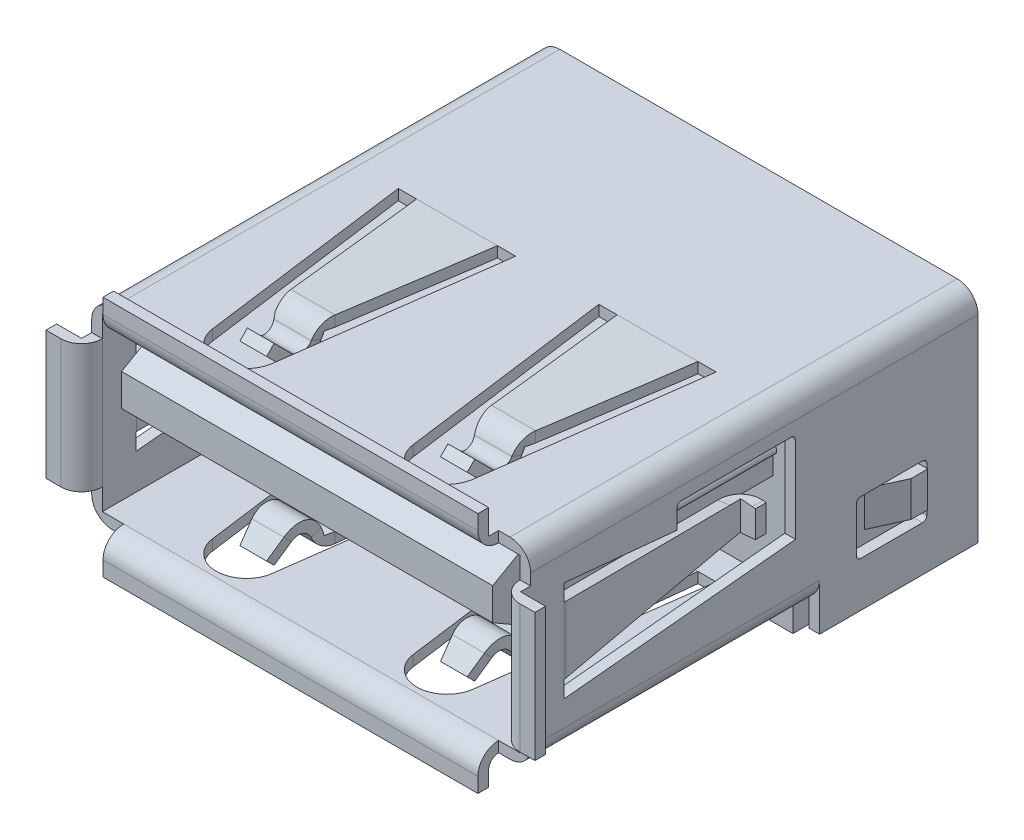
SolidWorks part; units mm, degrees
ref_plane "Front Plane" through (0, 0, 0) normal (0, 0, 1) x (1, 0, 0)
ref_plane "Top Plane" through (0, 0, 0) normal (0, 1, 0) x (1, 0, 0)
ref_plane "Right Plane" through (0, 0, 0) normal (1, 0, 0) x (0, 0, -1)
imported_body "Imported3"
ref_plane "Plane1" through (0, 0.14, 0) normal (0, 1, 0) x (1, 0, 0)
sketch "Sketch1" plane through (0, 0.14, 0) normal (0, 1, 0) x (1, 0, 0)
  line L0 (-0.765, 9.88) -> (-1.61, 9.88)
  line L1 (-1.61, 9.88) -> (-1.61, 8.88)
  line L2 (-1.61, 8.88) -> (-0.765, 8.88)
  line L3 (-0.765, 8.88) -> (-0.765, 9.88)
extrude "Cut-Extrude1" cut sketch "Sketch1" against normal blind 0.73
sketch "Sketch2" plane through (0, 0.14, 0) normal (0, 1, 0) x (1, 0, 0)
  line L0 (1.235, 9.88) -> (0.39, 9.88)
  line L1 (0.39, 9.88) -> (0.39, 8.88)
  line L2 (0.39, 8.88) -> (1.235, 8.88)
  line L3 (1.235, 8.88) -> (1.235, 9.88)
extrude "Cut-Extrude2" cut sketch "Sketch2" against normal blind 0.73
sketch "Sketch3" plane through (0, 0.14, 0) normal (0, 1, 0) x (1, 0, 0)
  line L0 (3.735, 9.88) -> (2.89, 9.88)
  line L1 (2.89, 9.88) -> (2.89, 8.88)
  line L2 (2.89, 8.88) -> (3.735, 8.88)
  line L3 (3.735, 8.88) -> (3.735, 9.88)
extrude "Cut-Extrude3" cut sketch "Sketch3" against normal blind 0.73
sketch "Sketch4" plane through (0, 0.14, 0) normal (0, 1, 0) x (1, 0, 0)
  line L0 (-3.265, 9.88) -> (-3.735, 9.88)
  line L1 (-3.735, 9.88) -> (-3.735, 8.88)
  line L2 (-3.735, 8.88) -> (-3.265, 8.88)
  line L3 (-3.265, 8.88) -> (-3.265, 9.88)
extrude "Cut-Extrude4" cut sketch "Sketch4" against normal blind 0.93
sketch "Sketch5" plane through (0, 0.14, 0) normal (0, 1, 0) x (1, 0, 0)
  line L0 (-2.89, 9.88) -> (-3.265, 9.88)
  line L1 (-3.265, 9.88) -> (-3.265, 8.88)
  line L2 (-3.265, 8.88) -> (-2.89, 8.88)
  line L3 (-2.89, 8.88) -> (-2.89, 9.88)
extrude "Cut-Extrude5" cut sketch "Sketch5" against normal blind 0.73
ref_plane "Plane2" through (-0.765, 0, 0) normal (1, 0, 0) x (0, 0, -1)
sketch "Sketch6" plane through (-0.765, 0, 0) normal (1, 0, 0) x (0, 0, -1)
  line L0 (9.88, -0.79) -> (9.88, -0.59)
  line L1 (9.88, -0.59) -> (8.88, -0.59)
  line L2 (8.88, -0.59) -> (8.88, -0.79)
  line L3 (8.88, -0.79) -> (9.88, -0.79)
extrude "Cut-Extrude6" cut sketch "Sketch6" against normal blind 0.47
sketch "Sketch7" plane through (0, 0.14, 0) normal (0, 1, 0) x (1, 0, 0)
  line L0 (-0.39, 9.88) -> (-0.765, 9.88)
  line L1 (-0.765, 9.88) -> (-0.765, 8.88)
  line L2 (-0.765, 8.88) -> (-0.39, 8.88)
  line L3 (-0.39, 8.88) -> (-0.39, 9.88)
extrude "Cut-Extrude7" cut sketch "Sketch7" against normal blind 0.73
ref_plane "Plane3" through (1.235, 0, 0) normal (1, 0, 0) x (0, 0, -1)
sketch "Sketch8" plane through (1.235, 0, 0) normal (1, 0, 0) x (0, 0, -1)
  line L0 (9.88, -0.79) -> (9.88, -0.59)
  line L1 (9.88, -0.59) -> (8.88, -0.59)
  line L2 (8.88, -0.59) -> (8.88, -0.79)
  line L3 (8.88, -0.79) -> (9.88, -0.79)
extrude "Cut-Extrude8" cut sketch "Sketch8" against normal blind 0.47
sketch "Sketch9" plane through (0, 0.14, 0) normal (0, 1, 0) x (1, 0, 0)
  line L0 (1.61, 9.88) -> (1.235, 9.88)
  line L1 (1.235, 9.88) -> (1.235, 8.88)
  line L2 (1.235, 8.88) -> (1.61, 8.88)
  line L3 (1.61, 8.88) -> (1.61, 9.88)
extrude "Cut-Extrude9" cut sketch "Sketch9" against normal blind 0.73
ref_plane "Plane4" through (3.735, 0, 0) normal (1, 0, 0) x (0, 0, -1)
sketch "Sketch10" plane through (3.735, 0, 0) normal (1, 0, 0) x (0, 0, -1)
  line L0 (9.88, -0.79) -> (9.88, -0.59)
  line L1 (9.88, -0.59) -> (8.88, -0.59)
  line L2 (8.88, -0.59) -> (8.88, -0.79)
  line L3 (8.88, -0.79) -> (9.88, -0.79)
extrude "Cut-Extrude10" cut sketch "Sketch10" against normal blind 0.47
sketch "Sketch11" plane through (0, 0.14, 0) normal (0, 1, 0) x (1, 0, 0)
  line L0 (4.11, 9.88) -> (3.735, 9.88)
  line L1 (3.735, 9.88) -> (3.735, 8.88)
  line L2 (3.735, 8.88) -> (4.11, 8.88)
  line L3 (4.11, 8.88) -> (4.11, 9.88)
extrude "Cut-Extrude11" cut sketch "Sketch11" against normal blind 0.73
sketch "Sketch12" plane through (0, 0.14, 0) normal (0, 1, 0) x (1, 0, 0)
  line L0 (-3.735, 9.88) -> (-4.11, 9.88)
  line L1 (-4.11, 9.88) -> (-4.11, 8.88)
  line L2 (-4.11, 8.88) -> (-3.735, 8.88)
  line L3 (-3.735, 8.88) -> (-3.735, 9.88)
extrude "Cut-Extrude12" cut sketch "Sketch12" against normal blind 0.73
sketch "Sketch13" plane through (0, 1, 0) normal (0, -1, 0) x (1, 0, 0)
  line L0 (-6.247, -8.54) -> (-6.247, -1.62)
  line L1 (-6.247, -1.62) -> (-6.565, -1.62)
  line L2 (-6.565, -1.62) -> (-6.565, -8.54)
  line L3 (-6.565, -8.54) -> (-6.247, -8.54)
extrude "Cut-Extrude13" cut sketch "Sketch13" against normal blind 0.1752
sketch "Sketch14" plane through (0, 0, 0) normal (0, 0, 1) x (1, 0, 0)
  line L0 (6.247, 1.92) -> (6.565, 1.92)
  line L1 (6.565, 1.92) -> (6.565, 2.878)
  line L2 (6.565, 2.878) -> (5.607, 2.878)
  line L3 (5.607, 2.878) -> (5.607, 2.56)
  line L4 (5.607, 2.56) -> (6.247, 2.56)
  line L5 (6.247, 2.56) -> (6.247, 1.92)
extrude "Cut-Extrude14" cut sketch "Sketch14" against normal blind 0.62
sketch "Sketch15" plane through (0, 0, 0) normal (0, 0, 1) x (1, 0, 0)
  line L0 (-5.607, 2.56) -> (-5.607, 2.878)
  line L1 (-5.607, 2.878) -> (-6.565, 2.878)
  line L2 (-6.565, 2.878) -> (-6.565, 1.92)
  line L3 (-6.565, 1.92) -> (-6.247, 1.92)
  line L4 (-6.247, 1.92) -> (-6.247, 2.56)
  line L5 (-6.247, 2.56) -> (-5.607, 2.56)
extrude "Cut-Extrude15" cut sketch "Sketch15" against normal blind 0.62
sketch "Sketch16" plane through (0, 0, 0) normal (0, 0, 1) x (1, 0, 0)
  line L0 (-6.247, -1.92) -> (-6.565, -1.92)
  line L1 (-6.565, -1.92) -> (-6.565, -2.878)
  line L2 (-6.565, -2.878) -> (-5.607, -2.878)
  line L3 (-5.607, -2.878) -> (-5.607, -2.56)
  line L4 (-5.607, -2.56) -> (-6.247, -2.56)
  line L5 (-6.247, -2.56) -> (-6.247, -1.92)
extrude "Cut-Extrude16" cut sketch "Sketch16" against normal blind 0.62
sketch "Sketch17" plane through (0, 0, 0) normal (0, 0, 1) x (1, 0, 0)
  line L0 (5.607, -2.56) -> (5.607, -2.878)
  line L1 (5.607, -2.878) -> (6.565, -2.878)
  line L2 (6.565, -2.878) -> (6.565, -1.92)
  line L3 (6.565, -1.92) -> (6.247, -1.92)
  line L4 (6.247, -1.92) -> (6.247, -2.56)
  line L5 (6.247, -2.56) -> (5.607, -2.56)
extrude "Cut-Extrude17" cut sketch "Sketch17" against normal blind 0.62
sketch "Sketch18" plane through (0, 1.1752, 0) normal (0, -1, 0) x (1, 0, 0)
  line L0 (-6.247, -8.54) -> (-6.247, -5)
  line L1 (-6.247, -5) -> (-6.565, -5)
  line L2 (-6.565, -5) -> (-6.565, -8.54)
  line L3 (-6.565, -8.54) -> (-6.247, -8.54)
extrude "Cut-Extrude18" cut sketch "Sketch18" against normal blind 0.7028
sketch "Sketch19" plane through (0, -1, 0) normal (0, 1, 0) x (-1, 0, 0)
  line L0 (6.247, -1.62) -> (6.247, -8.54)
  line L1 (6.247, -8.54) -> (6.565, -8.54)
  line L2 (6.565, -8.54) -> (6.565, -1.62)
  line L3 (6.565, -1.62) -> (6.247, -1.62)
extrude "Cut-Extrude19" cut sketch "Sketch19" against normal blind 0.5023
sketch "Sketch20" plane through (0, 1, 0) normal (0, -1, 0) x (1, 0, 0)
  line L0 (6.247, -1.62) -> (6.247, -8.54)
  line L1 (6.247, -8.54) -> (6.565, -8.54)
  line L2 (6.565, -8.54) -> (6.565, -1.62)
  line L3 (6.565, -1.62) -> (6.247, -1.62)
extrude "Cut-Extrude20" cut sketch "Sketch20" against normal blind 0.1752
sketch "Sketch21" plane through (0, 1.1752, 0) normal (0, -1, 0) x (1, 0, 0)
  line L0 (6.247, -5) -> (6.247, -8.54)
  line L1 (6.247, -8.54) -> (6.565, -8.54)
  line L2 (6.565, -8.54) -> (6.565, -5)
  line L3 (6.565, -5) -> (6.247, -5)
extrude "Cut-Extrude21" cut sketch "Sketch21" against normal blind 0.7028
sketch "Sketch22" plane through (0, -1, 0) normal (0, 1, 0) x (-1, 0, 0)
  line L0 (-6.247, -8.54) -> (-6.247, -1.62)
  line L1 (-6.247, -1.62) -> (-6.565, -1.62)
  line L2 (-6.565, -1.62) -> (-6.565, -8.54)
  line L3 (-6.565, -8.54) -> (-6.247, -8.54)
extrude "Cut-Extrude22" cut sketch "Sketch22" against normal blind 0.5023
sketch "Sketch23" plane through (0, -2.878, 0) normal (0, -1, 0) x (1, 0, 0)
  line L0 (5.607, 0) -> (5.607, -0.318)
  line L1 (5.607, -0.318) -> (-5.607, -0.318)
  line L2 (-5.607, -0.318) -> (-5.607, 0)
  line L3 (-5.607, 0) -> (5.607, 0)
extrude "Boss-Extrude1" add sketch "Sketch23" along normal blind 0.747
sketch "Sketch24" plane through (-6.565, 0, 0) normal (-1, 0, 0) x (0, 0, 1)
  line L0 (0, -1.92) -> (-0.318, -1.92)
  line L1 (-0.318, -1.92) -> (-0.318, 1.92)
  line L2 (-0.318, 1.92) -> (0, 1.92)
  line L3 (0, 1.92) -> (0, -1.92)
extrude "Boss-Extrude2" add sketch "Sketch24" along normal blind 0.747
sketch "Sketch25" plane through (0, 2.878, 0) normal (0, 1, 0) x (-1, 0, 0)
  line L0 (-5.607, -0.318) -> (-5.607, 0)
  line L1 (-5.607, 0) -> (5.607, 0)
  line L2 (5.607, 0) -> (5.607, -0.318)
  line L3 (5.607, -0.318) -> (-5.607, -0.318)
extrude "Boss-Extrude3" add sketch "Sketch25" along normal blind 0.747
sketch "Sketch26" plane through (6.565, 0, 0) normal (1, 0, 0) x (0, 0, -1)
  line L0 (0.318, -1.92) -> (0, -1.92)
  line L1 (0, -1.92) -> (0, 1.92)
  line L2 (0, 1.92) -> (0.318, 1.92)
  line L3 (0.318, 1.92) -> (0.318, -1.92)
extrude "Boss-Extrude4" add sketch "Sketch26" along normal blind 0.747
sketch "Sketch27" plane through (0, 0, -8.88) normal (0, 0, 1) x (1, 0, 0)
  line L0 (-5.7181, 0.84) -> (-5.55, 1.0081)
  line L1 (-5.55, 1.0081) -> (-5.55, 0.6719)
  line L2 (-5.55, 0.6719) -> (-5.7181, 0.84)
extrude "Boss-Extrude5" add sketch "Sketch27" along normal blind 5.38
sketch "Sketch28" plane through (0, 0, -8.88) normal (0, 0, 1) x (1, 0, 0)
  line L0 (5.7181, 0.84) -> (5.55, 0.6719)
  line L1 (5.55, 0.6719) -> (5.55, 1.0081)
  line L2 (5.55, 1.0081) -> (5.7181, 0.84)
extrude "Boss-Extrude6" add sketch "Sketch28" along normal blind 5.38
sketch "Sketch29" plane through (-6.565, 0, 0) normal (-1, 0, 0) x (0, 0, 1)
  line L0 (-10.36, -0.7) -> (-12.47, -0.7)
  line L1 (-12.47, -0.7) -> (-12.47, -2.3)
  line L2 (-12.47, -2.3) -> (-10.36, -2.3)
  line L3 (-10.36, -2.3) -> (-10.36, -0.7)
extrude "Cut-Extrude23" cut sketch "Sketch29" against normal blind 0.318
sketch "Sketch30" plane through (-6.247, 0, 0) normal (-1, 0, 0) x (0, 0, 1)
  line L0 (-12.38, -1.93) -> (-12.38, -0.87)
  line L1 (-12.38, -0.87) -> (-11.88, -0.87)
  line L2 (-11.88, -0.87) -> (-11.88, -1.93)
  line L3 (-11.88, -1.93) -> (-12.38, -1.93)
extrude "Boss-Extrude7" add sketch "Sketch30" along normal blind 0.433
sketch "Sketch31" plane through (6.565, 0, 0) normal (1, 0, 0) x (0, 0, -1)
  line L0 (12.47, -0.7) -> (10.36, -0.7)
  line L1 (10.36, -0.7) -> (10.36, -2.3)
  line L2 (10.36, -2.3) -> (12.47, -2.3)
  line L3 (12.47, -2.3) -> (12.47, -0.7)
extrude "Cut-Extrude24" cut sketch "Sketch31" against normal blind 0.318
sketch "Sketch32" plane through (6.247, 0, 0) normal (1, 0, 0) x (0, 0, -1)
  line L0 (11.88, -1.93) -> (11.88, -0.87)
  line L1 (11.88, -0.87) -> (12.38, -0.87)
  line L2 (12.38, -0.87) -> (12.38, -1.93)
  line L3 (12.38, -1.93) -> (11.88, -1.93)
extrude "Boss-Extrude8" add sketch "Sketch32" along normal blind 0.433
ref_plane "Plane5" through (0, 0, -13.625) normal (0, 0, -1) x (0, 1, 0)
ref_plane "Plane6" through (0, 0, -13.875) normal (0, 0, 1) x (1, 0, 0)
sketch "Sketch34" plane through (0, 0, -13.875) normal (0, 0, 1) x (1, 0, 0)
  line L0 (5.7738, -1.0331) -> (5.7738, -0.7967)
  line L1 (5.7738, -0.7967) -> (5.6979, -0.7967)
  line L2 (5.6979, -0.7967) -> (5.6979, -1.0331)
  arc A0 (5.6979, -1.0331) -> (5.7738, -1.0331) centre (5.7359, -1.0331) ccw
extrude "Boss-Extrude9" add sketch "Sketch34" against normal blind 0.125
sketch "Sketch37" plane through (0, -2.878, 0) normal (0, -1, 0) x (1, 0, 0)
  line L0 (-6.565, -14) -> (-6.565, -9.26)
  line L1 (-6.565, -9.26) -> (-6.247, -9.26)
  line L2 (-6.247, -9.26) -> (-6.247, -14)
  line L3 (-6.247, -14) -> (-6.565, -14)
extrude "Boss-Extrude11" add sketch "Sketch37" along normal blind 0.772
sketch "Sketch38" plane through (0, -2.878, 0) normal (0, -1, 0) x (1, 0, 0)
  line L0 (6.247, -14) -> (6.247, -9.26)
  line L1 (6.247, -9.26) -> (6.565, -9.26)
  line L2 (6.565, -9.26) -> (6.565, -14)
  line L3 (6.565, -14) -> (6.247, -14)
extrude "Boss-Extrude12" add sketch "Sketch38" along normal blind 0.772
sketch "Sketch39" plane through (0, -2.878, 0) normal (0, -1, 0) x (1, 0, 0)
  line L0 (-6.15, -8.88) -> (6.15, -8.88)
  line L1 (6.15, -8.88) -> (6.15, -14)
  line L2 (6.15, -14) -> (-6.15, -14)
  line L3 (-6.15, -14) -> (-6.15, -8.88)
extrude "Boss-Extrude13" add sketch "Sketch39" along normal blind 0.772
sketch "Sketch41" plane through (0, 0, -8.88) normal (0, 0, 1) x (1, 0, 0)
  line L0 (-3.6, -1.2438) -> (-3.5162, -1.2438)
  line L1 (-3.5162, -1.2438) -> (-3.5162, -1.7)
  line L2 (-3.5162, -1.7) -> (-3.4325, -1.7)
  line L3 (-3.4325, -1.7) -> (-3.4325, -1.03)
  line L4 (-3.4325, -1.03) -> (-3.5162, -1.03)
  line L5 (-3.6, -1.1298) -> (-3.6, -1.2438)
  spline S0 degree 3 poles (-3.6, -1.1298) (-3.5721, -1.0965) (-3.5442, -1.0633) (-3.5162, -1.03) knots 0 0 0 0 1 1 1 1
extrude "Cut-Extrude28" cut sketch "Sketch41" against normal blind 0.165
draft "Draft6" type of draft neutral plane draft angle 65.63 faces to draft 1 parameters "D1"=65.63
draft "Draft7" type of draft neutral plane draft angle 49.994 faces to draft 1 parameters "D1"=49.994
draft "Draft8" type of draft neutral plane draft angle 5.528 faces to draft 1 parameters "D1"=5.528
draft "Draft9" type of draft neutral plane draft angle 5.528 faces to draft 1 parameters "D1"=5.528
draft "Draft10" type of draft neutral plane draft angle 5.528 faces to draft 1 parameters "D1"=5.528
draft "Draft11" type of draft neutral plane draft angle 5.528 faces to draft 1 parameters "D1"=5.528
draft "Draft12" type of draft neutral plane draft angle 0.108 faces to draft 1 parameters "D1"=0.108
draft "Draft13" type of draft neutral plane draft angle 65.63 faces to draft 1 parameters "D1"=65.63
draft "Draft14" type of draft neutral plane draft angle 5.539 faces to draft 2 parameters "D1"=5.539
chamfer "Chamfer2" distance 0.38 angle 60 1 edges at (0, 0.14, -0.5)
fillet "Fillet1" radius 0.13 14 edges at (-6.406, -0.7, -12.47) (6.406, 1.878, -5) (-5.7181, 0.84, -6.19) (5.7181, 0.84, -6.19) (6.406, -2.3, -12.47) (-6.406, 1.878, -8.54) (-6.406, -0.7, -10.36) (6.406, -2.3, -10.36) (6.406, -0.7, -12.47) (6.406, -0.7, -10.36) (6.406, 1.878, -8.54) (-6.406, -2.3, -10.36) (-6.406, -2.3, -12.47) (-6.406, 1.878, -5)
fillet "Fillet3" radius 0.302 1 edges at (0, -2.878, -0.318)
fillet "Fillet4" radius 0.62 28 edges at (-5.604, 0, -7.82) (-6.565, 0, -1.653) (5.604, 0, -7.82) (-6.565, 2.878, -7.31) (6.565, 0, -1.653) (6.565, 2.878, -7.31) (6.247, 1.92, -0.31) (5.607, 2.56, -0.31) (-5.607, 2.56, -0.31) (-6.247, 1.92, -0.31) (-6.247, -1.92, -0.31) (-5.607, -2.56, -0.31) (6.565, -2.878, -4.94) (5.607, -2.56, -0.31) (6.247, -1.92, -0.31) (-6.565, -2.878, -4.94) (-6.247, -2.878, -11.63) (-6.406, -2.878, -9.26) (6.406, -2.878, -9.26) (6.247, -2.878, -11.63) (-6.15, -2.878, -11.44) (6.15, -2.878, -11.44)
